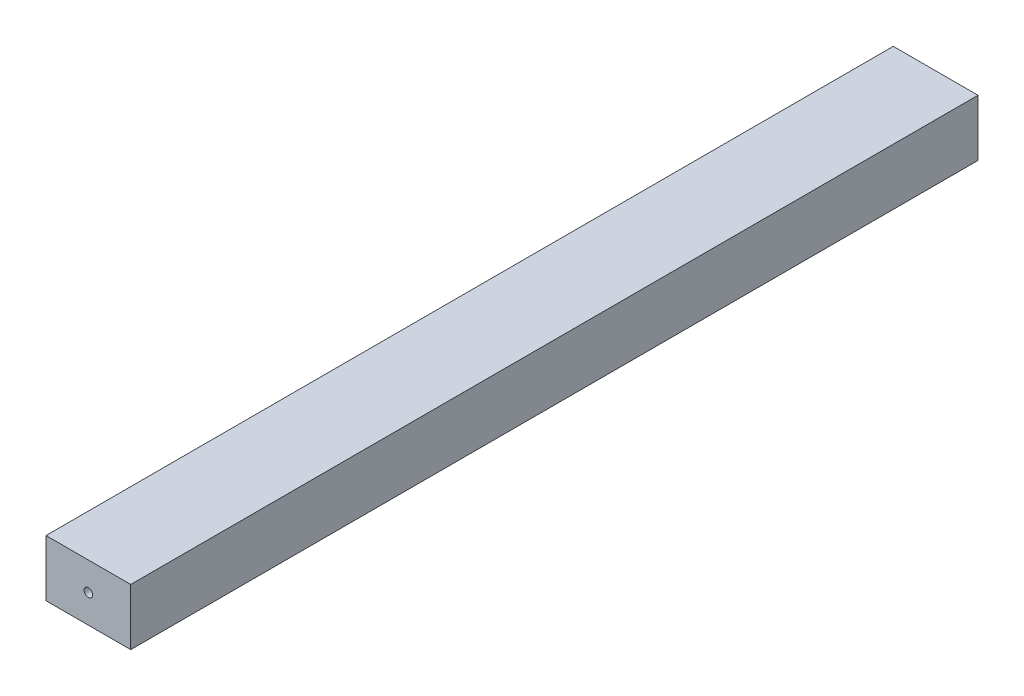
SolidWorks part; units mm, degrees
ref_plane "Plan de face" through (0, 0, 0) normal (0, 0, 1) x (1, 0, 0)
ref_plane "Plan de dessus" through (0, 0, 0) normal (0, 1, 0) x (1, 0, 0)
ref_plane "Plan de droite" through (0, 0, 0) normal (1, 0, 0) x (0, 0, -1)
sketch "Esquisse1" plane through (0, 0, 0) normal (0, 0, 1) x (1, 0, 0)
  line L1 (30, -20) -> (-30, -20)
  line L2 (30, -20) -> (30, 20)
  line L3 (30, 20) -> (-30, 20)
  line L4 (-30, -20) -> (-30, 20)
  line L5 (30, -20) -> (-30, 20) construction
  line L6 (30, 20) -> (-30, -20) construction
  circle A0 centre (0, 0) radius 3
  dimension "D3" = 6
  dimension "D1" = 60
  dimension "D2" = 40
extrude "Boss.-Extru.1" add sketch "Esquisse1" along normal blind 600
